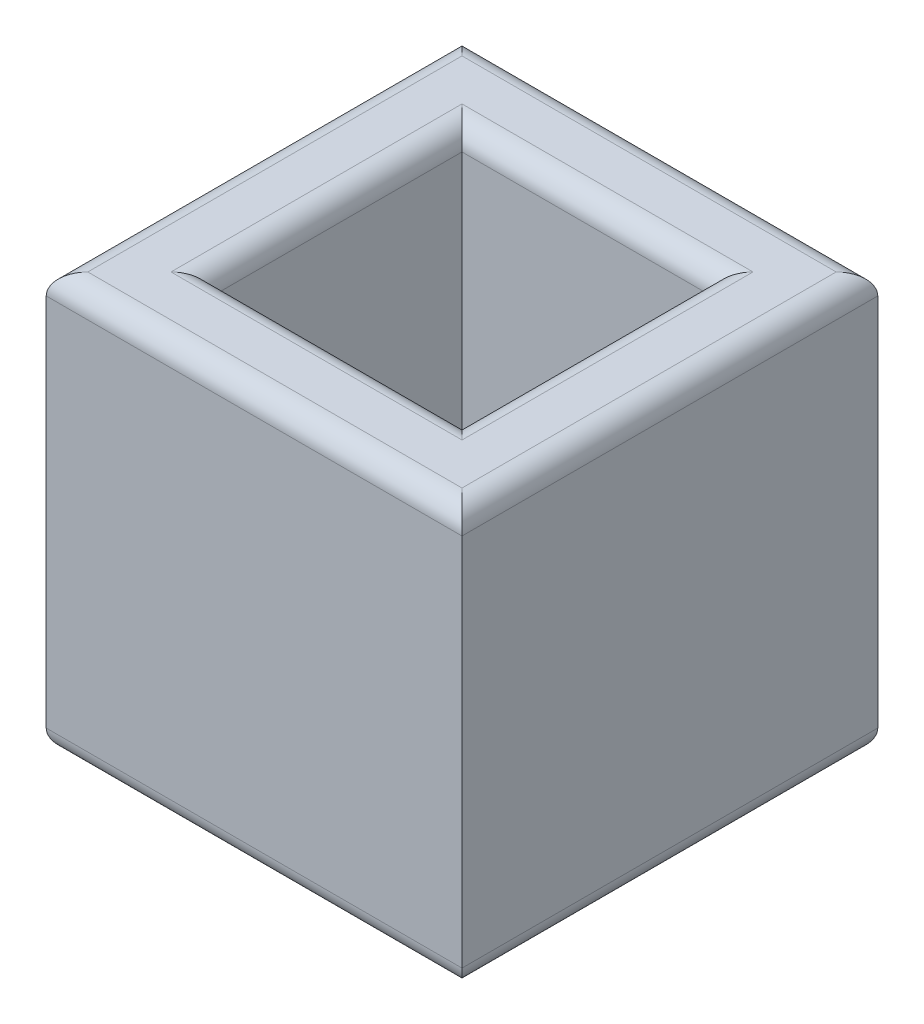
SolidWorks part; units mm, degrees
ref_plane "Front Plane" through (0, 0, 0) normal (0, 0, 1) x (1, 0, 0)
ref_plane "Top Plane" through (0, 0, 0) normal (0, 1, 0) x (1, 0, 0)
ref_plane "Right Plane" through (0, 0, 0) normal (1, 0, 0) x (0, 0, -1)
sketch "Sketch1" plane through (0, 0, 0) normal (0, 1, 0) x (1, 0, 0)
  line L1 (0, 0) -> (127, 0)
  line L2 (0, 0) -> (0, 127)
  line L3 (0, 127) -> (127, 127)
  line L4 (127, 0) -> (127, 127)
  dimension "D1" = 127
extrude "Boss-Extrude1" add sketch "Sketch1" along normal blind 127
sketch "Sketch2" plane through (0, 127, 0) normal (0, 1, 0) x (1, 0, 0)
  line L1 (25.4, 25.4) -> (101.6, 25.4)
  line L2 (25.4, 25.4) -> (25.4, 101.6)
  line L3 (25.4, 101.6) -> (101.6, 101.6)
  line L4 (101.6, 25.4) -> (101.6, 101.6)
  line L5 (0, 0) -> (127, 0) construction
  dimension "D1" = 76.2
  dimension "D2" = 25.4
  dimension "D3" = 25.4
extrude "Cut-Extrude1" cut sketch "Sketch2" against normal through all
fillet "Fillet1" radius 6.35 16 edges at (63.5, 0, 0) (127, 0, -63.5) (63.5, 0, -127) (0, 0, -63.5) (63.5, 0, -101.6) (101.6, 0, -63.5) (63.5, 0, -25.4) (25.4, 0, -63.5) (63.5, 127, -127) (127, 127, -63.5) (63.5, 127, 0) (0, 127, -63.5) (101.6, 127, -63.5) (63.5, 127, -101.6) (25.4, 127, -63.5) (63.5, 127, -25.4)
